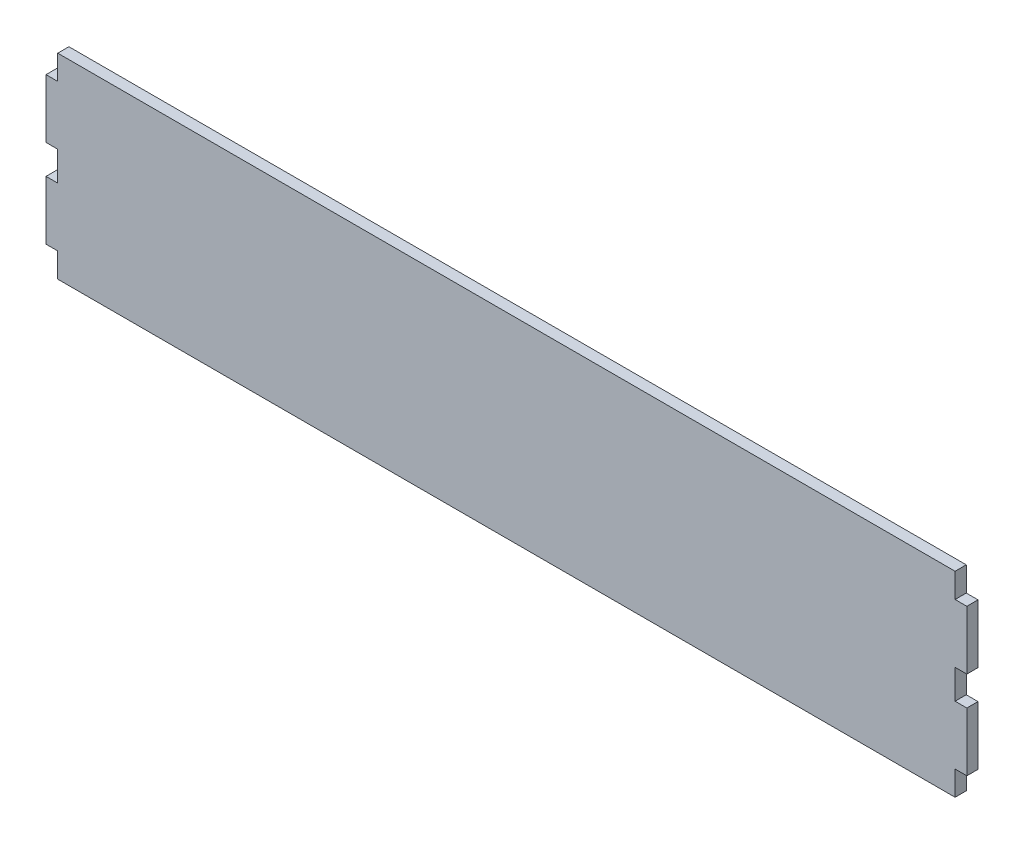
SolidWorks part; units mm, degrees
ref_plane "Alzado" through (0, 0, 0) normal (0, 0, 1) x (1, 0, 0)
ref_plane "Planta" through (0, 0, 0) normal (0, 1, 0) x (1, 0, 0)
ref_plane "Vista lateral" through (0, 0, 0) normal (1, 0, 0) x (0, 0, -1)
sketch "Croquis1" plane through (0, 0, 0) normal (0, 0, 1) x (1, 0, 0)
  line L1 (-229.2, -50) -> (229.2, -50)
  line L2 (-229.2, -50) -> (-229.2, 50)
  line L3 (-229.2, 50) -> (229.2, 50)
  line L4 (229.2, -50) -> (229.2, 50)
  line L5 (-229.2, -50) -> (229.2, 50) construction
  line L6 (-229.2, 50) -> (229.2, -50) construction
  point P0 (0, 0)
  dimension "D1" = 100
  dimension "D2" = 458.4
extrude "Saliente-Extruir1" add sketch "Croquis1" along normal blind 5.7
sketch "Croquis2" plane through (-229.2, 0, 0) normal (-1, 0, 0) x (0, 0, 1)
  line L0 (0, 50) -> (0, -50) construction
  line L1 (0, -37.5) -> (5.7, -37.5)
  line L2 (0, -37.5) -> (0, -7.5)
  line L3 (0, -7.5) -> (5.7, -7.5)
  line L4 (5.7, -37.5) -> (5.7, -7.5)
  line L5 (5.7, 50) -> (5.7, -50) construction
  line L6 (0, -7.5) -> (0, 7.5) construction
  line L7 (0, 7.5) -> (5.7, 7.5)
  line L8 (0, 7.5) -> (0, 37.5)
  line L9 (0, 37.5) -> (5.7, 37.5)
  line L10 (5.7, 7.5) -> (5.7, 37.5)
  point P12 (5.7, -22.5)
  point P13 (5.7, 22.5)
  point P14 (0, 0)
  dimension "D1" = 30
  dimension "D2" = 30
  dimension "D3" = 45
extrude "Saliente-Extruir2" add sketch "Croquis2" along normal blind 6
sketch "Croquis3" plane through (229.2, 0, 0) normal (1, 0, 0) x (0, 0, -1)
  line L0 (0, -50) -> (0, 50) construction
  line L1 (0, 37.5) -> (-5.7, 37.5)
  line L2 (0, 37.5) -> (0, 7.5)
  line L3 (0, 7.5) -> (-5.7, 7.5)
  line L4 (-5.7, 37.5) -> (-5.7, 7.5)
  line L5 (-5.7, -50) -> (-5.7, 50) construction
  line L6 (0, 7.5) -> (0, -7.5) construction
  line L7 (0, -7.5) -> (-5.7, -7.5)
  line L8 (0, -7.5) -> (0, -37.5)
  line L9 (0, -37.5) -> (-5.7, -37.5)
  line L10 (-5.7, -7.5) -> (-5.7, -37.5)
  point P13 (0, 0)
  point P14 (-5.7, 22.5)
  point P15 (-5.7, -22.5)
  dimension "D1" = 30
  dimension "D2" = 30
  dimension "D3" = 45
extrude "Saliente-Extruir3" add sketch "Croquis3" along normal blind 6
